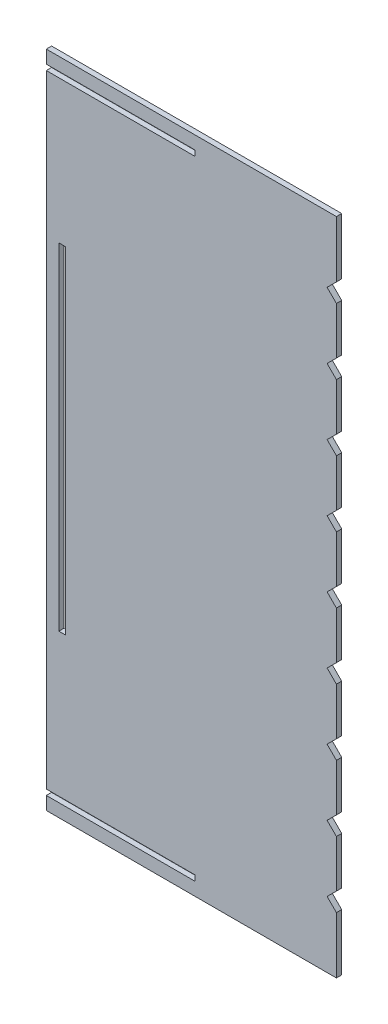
SolidWorks part; units mm, degrees
ref_plane "Спереди" through (0, 0, 0) normal (0, 0, 1) x (1, 0, 0)
ref_plane "Сверху" through (0, 0, 0) normal (0, 1, 0) x (1, 0, 0)
ref_plane "Справа" through (0, 0, 0) normal (1, 0, 0) x (0, 0, -1)
sketch "Model" plane through (0, 0, 0) normal (0, 0, 1) x (1, 0, 0)
  line L0 (-1631.6818, -832.3997) -> (-1631.6818, -577.3997)
  line L1 (-1631.6818, -577.3997) -> (-1636.6818, -577.3997)
  line L2 (-1636.6818, -577.3997) -> (-1636.6818, -832.3997)
  line L3 (-1636.6818, -832.3997) -> (-1631.6818, -832.3997)
  line L4 (-1426.1818, -454.8997) -> (-1426.1818, -497.8287)
  line L5 (-1426.1818, -497.8287) -> (-1433.253, -504.8997)
  line L6 (-1433.253, -504.8997) -> (-1426.1818, -511.9708)
  line L7 (-1426.1818, -511.9708) -> (-1426.1818, -547.8287)
  line L8 (-1426.1818, -547.8287) -> (-1433.253, -554.8997)
  line L9 (-1433.253, -554.8997) -> (-1426.1818, -561.9708)
  line L10 (-1426.1818, -561.9708) -> (-1426.1818, -597.8286)
  line L11 (-1426.1818, -597.8286) -> (-1433.253, -604.8997)
  line L12 (-1433.253, -604.8997) -> (-1426.1818, -611.9708)
  line L13 (-1426.1818, -611.9708) -> (-1426.1818, -647.8286)
  line L14 (-1426.1818, -647.8286) -> (-1433.253, -654.8997)
  line L15 (-1433.253, -654.8997) -> (-1426.1818, -661.9708)
  line L16 (-1426.1818, -661.9708) -> (-1426.1818, -697.8286)
  line L17 (-1426.1818, -697.8286) -> (-1433.253, -704.8997)
  line L18 (-1433.253, -704.8997) -> (-1426.1818, -711.9708)
  line L19 (-1426.1818, -711.9708) -> (-1426.1818, -747.8286)
  line L20 (-1426.1818, -747.8286) -> (-1433.253, -754.8997)
  line L21 (-1433.253, -754.8997) -> (-1426.1818, -761.9708)
  line L22 (-1426.1818, -761.9708) -> (-1426.1818, -797.8286)
  line L23 (-1426.1818, -797.8286) -> (-1433.253, -804.8997)
  line L24 (-1433.253, -804.8997) -> (-1426.1818, -811.9708)
  line L25 (-1426.1818, -811.9708) -> (-1426.1818, -847.8287)
  line L26 (-1426.1818, -847.8287) -> (-1433.253, -854.8997)
  line L27 (-1433.253, -854.8997) -> (-1426.1818, -861.9708)
  line L28 (-1426.1818, -861.9708) -> (-1426.1818, -897.8287)
  line L29 (-1426.1818, -897.8287) -> (-1433.253, -904.8997)
  line L30 (-1433.253, -904.8997) -> (-1426.1818, -911.9708)
  line L31 (-1426.1818, -911.9708) -> (-1426.1818, -954.8997)
  line L32 (-1426.1818, -954.8997) -> (-1646.1818, -954.8997)
  line L33 (-1646.1818, -954.8997) -> (-1646.1818, -944.9996)
  line L34 (-1646.1818, -944.9996) -> (-1533.3986, -944.9996)
  line L35 (-1533.3986, -944.9996) -> (-1533.3986, -944.8997)
  line L36 (-1533.3986, -944.8997) -> (-1533.3986, -940.8997)
  line L37 (-1533.3986, -940.8997) -> (-1533.3986, -940.7996)
  line L38 (-1533.3986, -940.7996) -> (-1646.1818, -940.7996)
  line L39 (-1646.1818, -940.7996) -> (-1646.1818, -468.9997)
  line L40 (-1646.1818, -468.9997) -> (-1533.3986, -468.9997)
  line L41 (-1533.3986, -468.9997) -> (-1533.3986, -468.8997)
  line L42 (-1533.3986, -468.8997) -> (-1533.3986, -464.8997)
  line L43 (-1533.3986, -464.8997) -> (-1533.3986, -464.7997)
  line L44 (-1533.3986, -464.7997) -> (-1646.1818, -464.7997)
  line L45 (-1646.1818, -464.7997) -> (-1646.1818, -454.8997)
  line L46 (-1646.1818, -454.8997) -> (-1426.1818, -454.8997)
extrude "Бобышка-Вытянуть1" add sketch "Model" along normal blind 4
